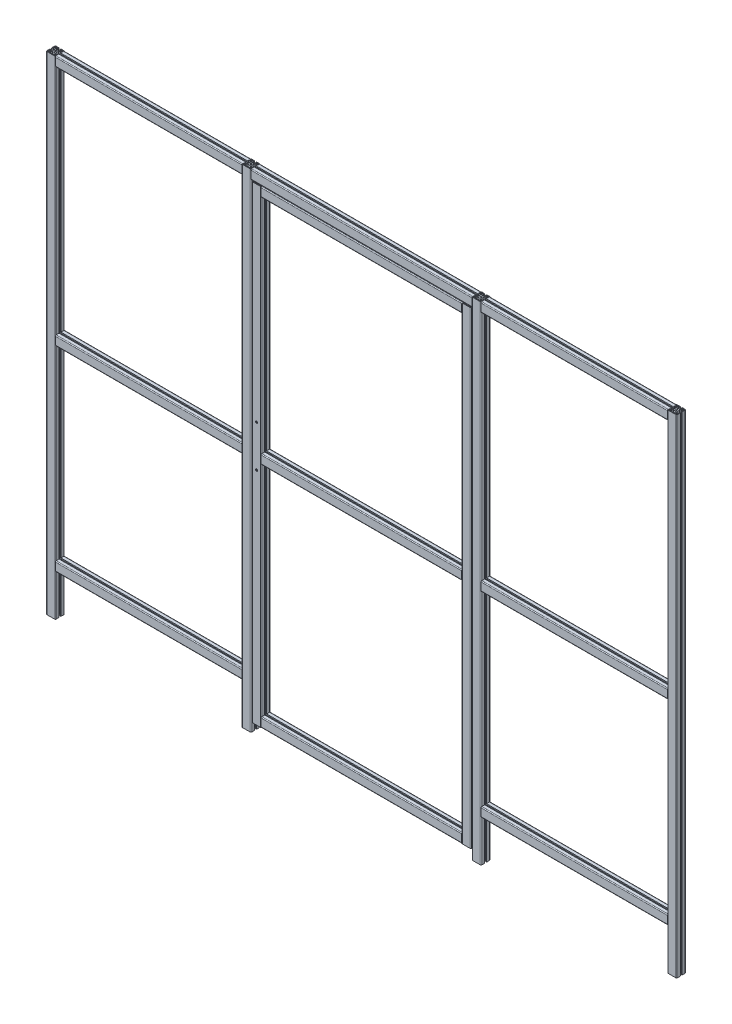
SolidWorks part; units mm, degrees
ref_plane "Top (Z)" through (0, 0, 0) normal (0, 0, 1) x (1, 0, 0)
ref_plane "Side (Y)" through (0, 0, 0) normal (0, 1, 0) x (1, 0, 0)
ref_plane "Front (X)" through (0, 0, 0) normal (1, 0, 0) x (0, 0, -1)
sketch3d "3DSketch1"
  line L0 (-1350, 0, 0) -> (-500, 0, 0)
  line L1 (-1350, 0, 0) -> (-1350, -2100, 0)
  line L2 (-500, 0, 0) -> (-500, -2100, 0)
  line L3 (1350, 0, 0) -> (1350, -2100, 0)
  line L4 (500, 0, 0) -> (500, -2100, 0)
  line L5 (-1350, -1050, 0) -> (-500, -1050, 0)
  line L6 (500, -1050, 0) -> (1350, -1050, 0)
  line L7 (0, 0, 0) -> (0, -44, 0) construction
  line L8 (-500, -1050, 0) -> (-456, -1050, 0) construction
  line L9 (500, -1050, 0) -> (456, -1050, 0) construction
  line L10 (-1350, -1900, 0) -> (-500, -1900, 0)
  line L11 (-456, -44, 0) -> (456, -44, 0)
  line L12 (-456, -44, 0) -> (-456, -2040, 0)
  line L13 (-456, -2040, 0) -> (456, -2040, 0)
  line L14 (456, -44, 0) -> (456, -2040, 0)
  line L15 (500, -1900, 0) -> (1350, -1900, 0)
  line L16 (-456, -1050, 0) -> (456, -1050, 0)
  line L17 (500, 0, 0) -> (-500, 0, 0)
  line L18 (500, 0, 0) -> (1350, 0, 0)
  point P25 (0, 0, 0)
  point P26 (0, 0, 0)
  point P28 (0, 0, 0)
  point P29 (-1350, -864.9114, 0)
  point P30 (-1350, -1050, 0)
  point P31 (1350, -1050, 0)
  point P32 (0, 0, 0)
  point P33 (-444.4955, -1042, 0)
  point P34 (0, 0, 0)
  point P35 (0, 0, 0)
  dimension "D1" = 850
  dimension "D2" = 850
  dimension "D3" = 2100
  dimension "D6" = 2700
  dimension "D7" = 44
  dimension "D8" = 44
  dimension "D9" = 44
  dimension "D10" = 200
  dimension "D11" = 60
other "Closed profiles 40 light SP5510N PROFILE 40X40 3N LET(1)"
ref_plane "Plane1" through (-1350, 0, 0) normal (0, -1, 0) x (0, 0, -1)
sketch "Sketch1" plane through (-1350, 0, 0) normal (0, -1, 0) x (0, 0, -1)
  line L8 (17.1, -11.7) -> (12.7, -11.7)
  line L9 (18.1, -15.6) -> (18.1, -12.7)
  line L10 (12.7, -18.1) -> (15.6, -18.1)
  line L11 (11.7, -12.7) -> (11.7, -17.1)
  line L16 (-11.7, -17.1) -> (-11.7, -12.7)
  line L17 (-15.6, -18.1) -> (-12.7, -18.1)
  line L18 (-18.1, -12.7) -> (-18.1, -15.6)
  line L19 (-12.7, -11.7) -> (-17.1, -11.7)
  line L24 (-17.1, 11.7) -> (-12.7, 11.7)
  line L25 (-18.1, 15.6) -> (-18.1, 12.7)
  line L26 (-12.7, 18.1) -> (-15.6, 18.1)
  line L27 (-11.7, 12.7) -> (-11.7, 17.1)
  line L32 (11.7, 17.1) -> (11.7, 12.7)
  line L33 (15.6, 18.1) -> (12.7, 18.1)
  line L34 (18.1, 12.7) -> (18.1, 15.6)
  line L35 (12.7, 11.7) -> (17.1, 11.7)
  line L92 (15.5, 4.1) -> (20, 4.1)
  line L93 (20, 4.1) -> (20, 16.5)
  line L94 (16.5, 20) -> (4.1, 20)
  line L95 (4.1, 20) -> (4.1, 15.5)
  line L96 (4.1, 15.5) -> (6, 15.5)
  line L97 (6, 15.5) -> (6, 18)
  line L98 (6, 18) -> (10, 18)
  line L99 (10, 18) -> (10, 12.121)
  line L100 (10, 12.121) -> (5.479, 7.6)
  line L101 (5.479, 7.6) -> (-5.479, 7.6)
  line L102 (-5.479, 7.6) -> (-10, 12.121)
  line L103 (-10, 12.121) -> (-10, 18)
  line L104 (-10, 18) -> (-6, 18)
  line L105 (-6, 18) -> (-6, 15.5)
  line L106 (-6, 15.5) -> (-4.1, 15.5)
  line L107 (-4.1, 15.5) -> (-4.1, 20)
  line L108 (-4.1, 20) -> (-16.5, 20)
  line L109 (-20, 16.5) -> (-20, -16.5)
  line L110 (-16.5, -20) -> (-4.1, -20)
  line L111 (-4.1, -20) -> (-4.1, -15.5)
  line L112 (-4.1, -15.5) -> (-6, -15.5)
  line L113 (-6, -15.5) -> (-6, -18)
  line L114 (-6, -18) -> (-10, -18)
  line L115 (-10, -18) -> (-10, -12.121)
  line L116 (-10, -12.121) -> (-5.479, -7.6)
  line L117 (-5.479, -7.6) -> (5.479, -7.6)
  line L118 (5.479, -7.6) -> (10, -12.121)
  line L119 (10, -12.121) -> (10, -18)
  line L120 (10, -18) -> (6, -18)
  line L121 (6, -18) -> (6, -15.5)
  line L122 (6, -15.5) -> (4.1, -15.5)
  line L123 (4.1, -15.5) -> (4.1, -20)
  line L124 (4.1, -20) -> (16.5, -20)
  line L125 (20, -16.5) -> (20, -4.1)
  line L126 (20, -4.1) -> (15.5, -4.1)
  line L127 (15.5, -4.1) -> (15.5, -6)
  line L128 (15.5, -6) -> (18, -6)
  line L129 (18, -6) -> (18, -10)
  line L130 (18, -10) -> (12.121, -10)
  line L131 (12.121, -10) -> (7.6, -5.479)
  line L132 (7.6, -5.479) -> (7.6, 5.479)
  line L133 (7.6, 5.479) -> (12.121, 10)
  line L134 (12.121, 10) -> (18, 10)
  line L135 (18, 10) -> (18, 6)
  line L136 (18, 6) -> (15.5, 6)
  line L137 (15.5, 6) -> (15.5, 4.1)
  line L152 (-18, -4.1) -> (-15.5, -4.1)
  line L153 (-18, 4.1) -> (-18, -4.1)
  line L154 (-15.5, 4.1) -> (-18, 4.1)
  line L155 (-15.5, 6) -> (-15.5, 4.1)
  line L156 (-18, 6) -> (-15.5, 6)
  line L157 (-18, 10) -> (-18, 6)
  line L158 (-12.121, 10) -> (-18, 10)
  line L159 (-7.6, 5.479) -> (-12.121, 10)
  line L160 (-7.6, -5.479) -> (-7.6, 5.479)
  line L161 (-12.121, -10) -> (-7.6, -5.479)
  line L162 (-18, -10) -> (-12.121, -10)
  line L163 (-18, -6) -> (-18, -10)
  line L164 (-15.5, -6) -> (-18, -6)
  line L165 (-15.5, -4.1) -> (-15.5, -6)
  circle A2 centre (0, 0) radius 3.4
  arc A8 (20, 16.5) -> (16.5, 20) centre (16.5, 16.5) ccw
  arc A9 (-16.5, 20) -> (-20, 16.5) centre (-16.5, 16.5) ccw
  arc A10 (-20, -16.5) -> (-16.5, -20) centre (-16.5, -16.5) ccw
  arc A11 (16.5, -20) -> (20, -16.5) centre (16.5, -16.5) ccw
  arc A16 (18.1, -12.7) -> (17.1, -11.7) centre (17.1, -12.7) ccw
  arc A17 (15.6, -18.1) -> (18.1, -15.6) centre (15.6, -15.6) ccw
  arc A18 (11.7, -17.1) -> (12.7, -18.1) centre (12.7, -17.1) ccw
  arc A19 (12.7, -11.7) -> (11.7, -12.7) centre (12.7, -12.7) ccw
  arc A24 (-12.7, -18.1) -> (-11.7, -17.1) centre (-12.7, -17.1) ccw
  arc A25 (-18.1, -15.6) -> (-15.6, -18.1) centre (-15.6, -15.6) ccw
  arc A26 (-17.1, -11.7) -> (-18.1, -12.7) centre (-17.1, -12.7) ccw
  arc A27 (-11.7, -12.7) -> (-12.7, -11.7) centre (-12.7, -12.7) ccw
  arc A32 (-18.1, 12.7) -> (-17.1, 11.7) centre (-17.1, 12.7) ccw
  arc A33 (-15.6, 18.1) -> (-18.1, 15.6) centre (-15.6, 15.6) ccw
  arc A34 (-11.7, 17.1) -> (-12.7, 18.1) centre (-12.7, 17.1) ccw
  arc A35 (-12.7, 11.7) -> (-11.7, 12.7) centre (-12.7, 12.7) ccw
  arc A40 (12.7, 18.1) -> (11.7, 17.1) centre (12.7, 17.1) ccw
  arc A41 (18.1, 15.6) -> (15.6, 18.1) centre (15.6, 15.6) ccw
  arc A42 (17.1, 11.7) -> (18.1, 12.7) centre (17.1, 12.7) ccw
  arc A43 (11.7, 12.7) -> (12.7, 11.7) centre (12.7, 12.7) ccw
  point P100 (0, 20)
  point P107 (20, 20)
  point P120 (-20, 20)
  point P121 (20, 0)
  point P122 (0, 0)
  point P123 (20, -20)
  point P124 (0, -20)
  point P125 (-20, -20)
  point P126 (-20, 0)
  point P127 (0, 0)
other "Trim/Extend1"
other "Trim/Extend2"
other "Trim/Extend3"
other "Trim/Extend4"
other "Trim/Extend5"
hole_wizard "CBORE for M8 Hex Socket Head Cap Screw1" positions "Sketch2" profile "Sketch3" counterbore size "M8" standard "ISO"
sketch "Sketch2" plane through (0, 0, -20) normal (0, 0, -1) x (-1, 0, 0)
  line L0 (436, -2060) -> (436, -24) construction
  line L3 (516.5, -2100) -> (504.1, -2100) construction
  point P0 (456, -1100)
  point P2 (456, -920)
  dimension "D1" = 20
  dimension "D2" = 20
  dimension "D3" = 180
  dimension "D4" = 1000
sketch "Sketch3" plane through (-456, -1100, -20) normal (1, 0, 0) x (0, 1, 0)
  line L0 (0, 0) -> (0, 40)
  line L1 (0, 40) -> (4.5, 40)
  line L3 (4.5, 40) -> (4.5, 12.5)
  line L4 (4.5, 12.5) -> (7.5, 12.5)
  line L5 (7.5, 12.5) -> (7.5, 0)
  line L7 (7.5, 0) -> (0, 0)
  line L11 (0, -6.35) -> (0, 107.95) construction
  dimension "Thru Hole Dia." = 9
  dimension "Thru Hole Depth" = 40
  dimension "C'Bore Dia." = 15
  dimension "C'Bore Depth" = 12.5
